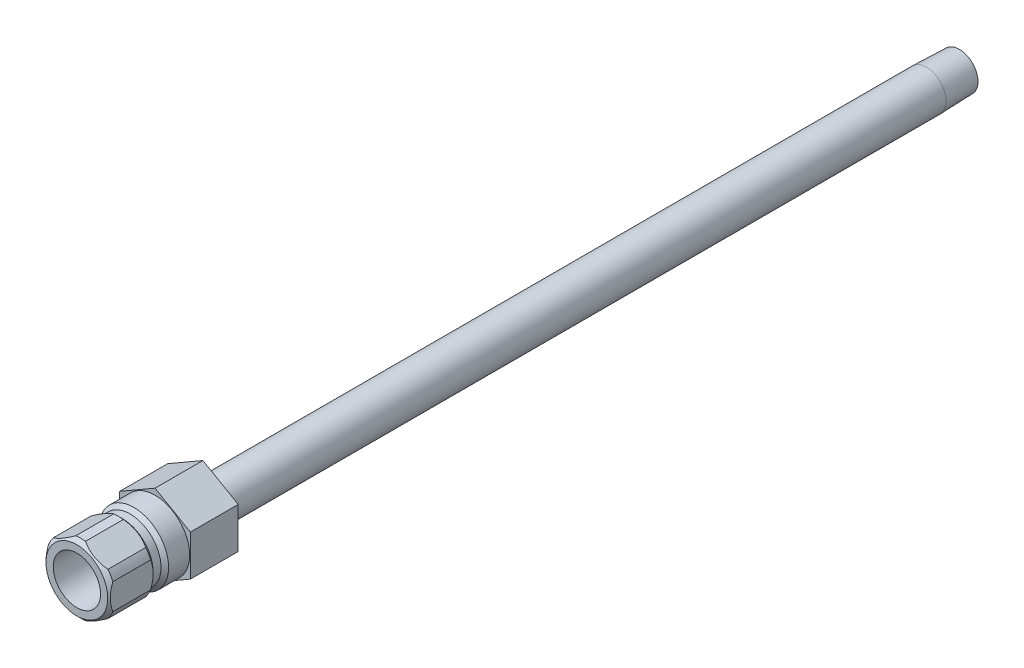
SolidWorks part; units mm, degrees
ref_plane "Front Plane" through (0, 0, 0) normal (0, 0, 1) x (1, 0, 0)
ref_plane "Top Plane" through (0, 0, 0) normal (0, 1, 0) x (1, 0, 0)
ref_plane "Right Plane" through (0, 0, 0) normal (1, 0, 0) x (0, 0, -1)
sketch "Sketch1" plane through (0, 0, 0) normal (1, 0, 0) x (0, 0, -1)
  line L0 (9.652, 0) -> (-18.923, 0) construction
  line L1 (-15.748, 4.7625) -> (-15.748, 6.223)
  line L2 (-6.604, 6.223) -> (-6.604, 0) construction
  line L3 (-14.986, 6.985) -> (-7.366, 6.985)
  line L4 (-3.556, 4.7625) -> (-2.4351, 2.6543)
  line L5 (-6.604, 6.223) -> (-5.0165, 6.223)
  line L6 (-4.2545, 6.985) -> (9.652, 6.985)
  line L7 (9.652, 6.985) -> (9.652, 3.9688)
  line L8 (-6.604, 6.223) -> (-7.366, 6.985)
  line L9 (-5.0165, 6.223) -> (-4.2545, 6.985)
  line L10 (-15.748, 6.223) -> (-14.986, 6.985)
  line L12 (9.652, 3.9688) -> (155.4226, 3.9688)
  line L13 (155.4226, 3.9688) -> (162.052, 3.7616)
  line L14 (162.052, 3.7616) -> (162.052, 2.6543)
  line L16 (9.652, 6.731) -> (9.652, 0) construction
  line L19 (-3.556, 4.7625) -> (-15.748, 4.7625)
  line L20 (-2.4351, 2.6543) -> (162.052, 2.6543)
  dimension "D2" = 1.5875
  dimension "D3" = 0.762
  dimension "D4" = 45
  dimension "D5" = 9.144
  dimension "D6" = 45
  dimension "D7" = 1.79
  dimension "D8" = 6.6294
  dimension "D9" = 177.8
  dimension "D10" = 3.175
  dimension "D11" = 9.525
  dimension "D12" = 7.9375
  dimension "D13" = 25.4
  dimension "D14" = 13.97
  dimension "D15" = 5.3086
  dimension "D16" = 118
  dimension "D17" = 12.192
  dimension "D18" = 15.748
revolve "Revolve1" add sketch "Sketch1" angle 360 about L0
sketch "Sketch2" plane through (0, 0, 0) normal (0, 0, 1) x (1, 0, 0)
  line L1 (-7.112, 4.1061) -> (-7.112, -4.1061)
  line L2 (-7.112, -4.1061) -> (0, -8.2122)
  line L3 (0, -8.2122) -> (7.112, -4.1061)
  line L4 (7.112, -4.1061) -> (7.112, 4.1061)
  line L5 (7.112, 4.1061) -> (0, 8.2122)
  line L6 (0, 8.2122) -> (-7.112, 4.1061)
  circle A0 centre (0, 0) radius 7.112 construction
  circle A2 centre (0, 0) radius 2.6543
  circle A3 centre (0, 0) radius 2.6543 construction
  dimension "D1" = 14.224
extrude "Boss-Extrude1" add sketch "Sketch2" against normal up to vertex (9.652 mm away)
sketch "Sketch3" plane through (0, 0, 0) normal (0, 0, 1) x (1, 0, 0)
  line L1 (6.477, 3.7395) -> (0, 7.479)
  line L2 (0, 7.479) -> (-6.477, 3.7395)
  line L3 (-6.477, 3.7395) -> (-6.477, -3.7395)
  line L4 (-6.477, -3.7395) -> (0, -7.479)
  line L5 (0, -7.479) -> (6.477, -3.7395)
  line L6 (6.477, -3.7395) -> (6.477, 3.7395)
  circle A0 centre (0, 0) radius 6.477 construction
  dimension "D1" = 12.954
extrude "Cut-Extrude1" cut sketch "Sketch3" along normal through all from vertex at 6.604 flip side to cut
